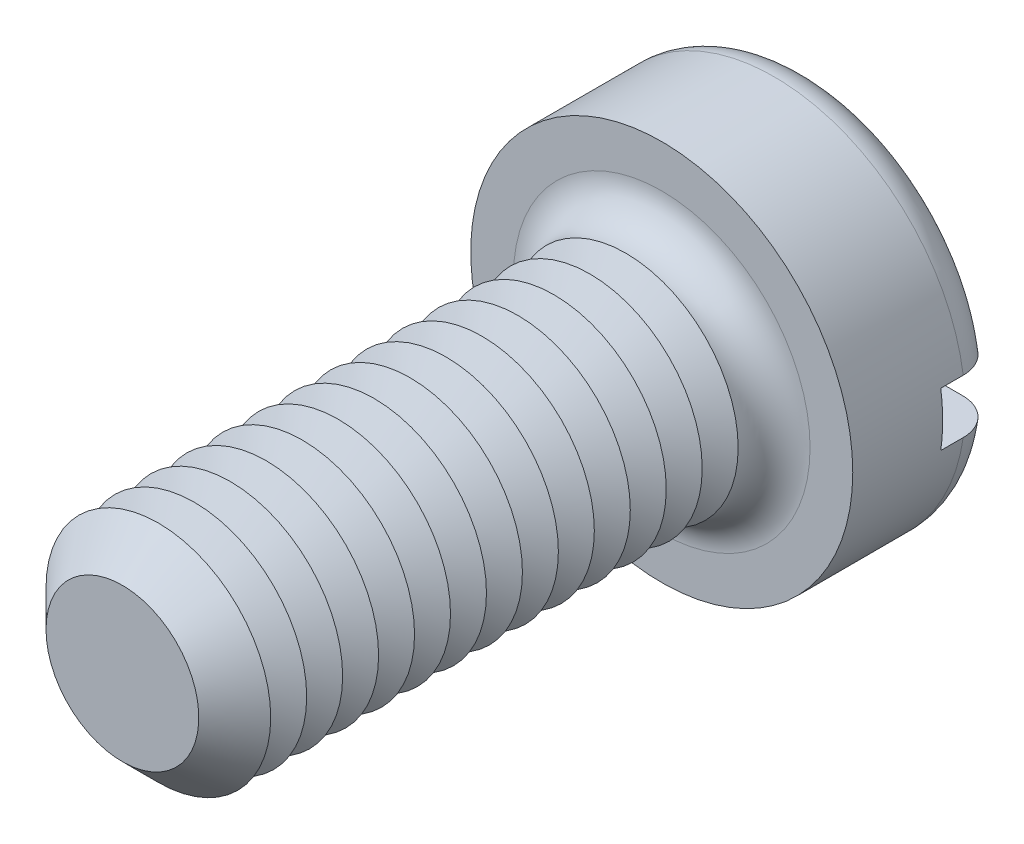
SolidWorks part; units mm, degrees
ref_plane "Front Plane" through (0, 0, 0) normal (0, 0, 1) x (1, 0, 0)
ref_plane "Top Plane" through (0, 0, 0) normal (0, 1, 0) x (1, 0, 0)
ref_plane "Right Plane" through (0, 0, 0) normal (1, 0, 0) x (0, 0, -1)
sketch "Sketch3" plane through (0, 0, 0) normal (0, 0, 1) x (1, 0, 0)
  circle A0 centre (0, 0) radius 4.25
  dimension "D1" = 8.5
extrude "Boss-Extrude2" add sketch "Sketch3" against normal blind 3.3
sketch "Sketch4" plane through (0, 0, 0) normal (0, 0, 1) x (1, 0, 0)
  circle A0 centre (0, 0) radius 2.5
  dimension "D1" = 5
extrude "Boss-Extrude3" add sketch "Sketch4" along normal blind 12
fillet "Fillet1" radius 0.8 2 edges at (4.25, 0, -3.3) (2.5, 0, 0)
chamfer "Chamfer1" distance 0.8 angle 45 1 edges at (2.5, 0, 12)
sketch "Sketch5" plane through (0, 0, 0) normal (1, 0, 0) x (0, 0, -1)
  line L0 (1.6944, 0) -> (-7.6738, 0) construction
sketch "Sketch6" plane through (0, 0, 0) normal (1, 0, 0) x (0, 0, -1)
  line L0 (-0.8, 2.5) -> (-1.2, 1.8072)
  line L1 (-1.2, 1.8072) -> (-1.6, 2.5)
  line L2 (-0.8, 2.5) -> (-11.2, 2.5) construction
  line L3 (-1.6, 2.5) -> (-0.8, 2.5)
  dimension "D1" = 0.8
revolve "Cut-Revolve1" cut sketch "Sketch6" angle 360 about L0
pattern_linear "LPattern1" count 13 spacing 0.8 along (0, 0, 1) of "Cut-Revolve1"
sketch "Sketch8" plane through (0, 0, -3.3) normal (0, 0, -1) x (-1, 0, 0)
  line L1 (4.25, -0.6) -> (-4.25, -0.6)
  line L2 (4.25, -0.6) -> (4.25, 0.6)
  line L3 (4.25, 0.6) -> (-4.25, 0.6)
  line L4 (-4.25, -0.6) -> (-4.25, 0.6)
  line L5 (4.25, -0.6) -> (-4.25, 0.6) construction
  line L6 (4.25, 0.6) -> (-4.25, -0.6) construction
  point P0 (0, 0)
  dimension "D1" = 8.5
  dimension "D2" = 1.2
extrude "Cut-Extrude1" cut sketch "Sketch8" against normal blind 1.3
